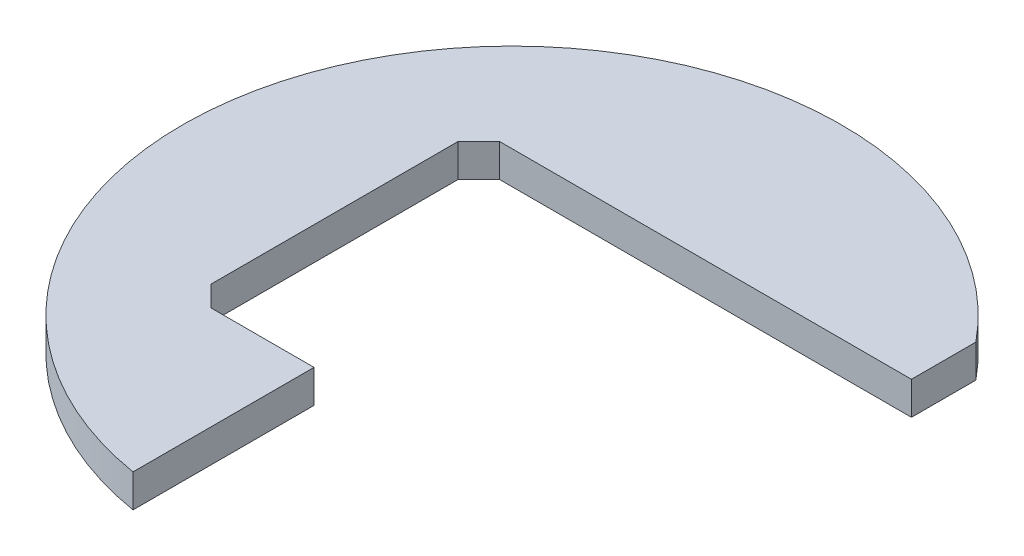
SolidWorks part; units mm, degrees
ref_plane "Front Plane" through (0, 0, 0) normal (0, 0, 1) x (1, 0, 0)
ref_plane "Top Plane" through (0, 0, 0) normal (0, 1, 0) x (1, 0, 0)
ref_plane "Right Plane" through (0, 0, 0) normal (1, 0, 0) x (0, 0, -1)
sketch "Sketch1" plane through (0, 0, 0) normal (0, 1, 0) x (1, 0, 0)
  line L0 (-7.6125, 7) -> (-8.6125, 6)
  line L1 (12.3875, 7) -> (-7.6125, 7)
  line L2 (14.3875, 7) -> (14.3875, -7) construction
  line L3 (-2.6125, -7) -> (-7.6125, -7)
  line L4 (-8.6125, 6) -> (-8.6125, -6)
  line L5 (-7.6125, -7) -> (-8.6125, -6)
  line L6 (12.3875, 10.1267) -> (12.3875, 7)
  line L7 (14.3875, 7) -> (12.3875, 7) construction
  line L8 (12.3875, 7) -> (12.3875, -7) construction
  line L9 (12.3875, -7) -> (12.3875, -10.1267) construction
  line L10 (14.3875, -7) -> (12.3875, -7) construction
  line L11 (-2.6125, -7) -> (-2.6125, -15.7853)
  line L12 (12.3875, -7) -> (-2.6125, -7) construction
  arc A0 (12.3875, 10.1267) -> (-2.6125, -15.7853) centre (0, 0) ccw
  arc A1 (14.3875, -7) -> (14.3875, 7) centre (0, 0) ccw construction
  arc A2 (14.3875, 7) -> (12.3875, 10.1267) centre (0, 0) ccw construction
  arc A3 (12.3875, -10.1267) -> (14.3875, -7) centre (0, 0) ccw construction
  arc A4 (-2.6125, -15.7853) -> (12.3875, -10.1267) centre (0, 0) ccw construction
  point P4 (-8.6125, -7)
  point P6 (-8.6125, 7)
  dimension "D1" = 32
  dimension "D2" = 14
  dimension "D3" = 23
  dimension "D4" = 2
  dimension "D5" = 15
extrude "Boss-Extrude1" add sketch "Sketch1" along normal blind 1.6
